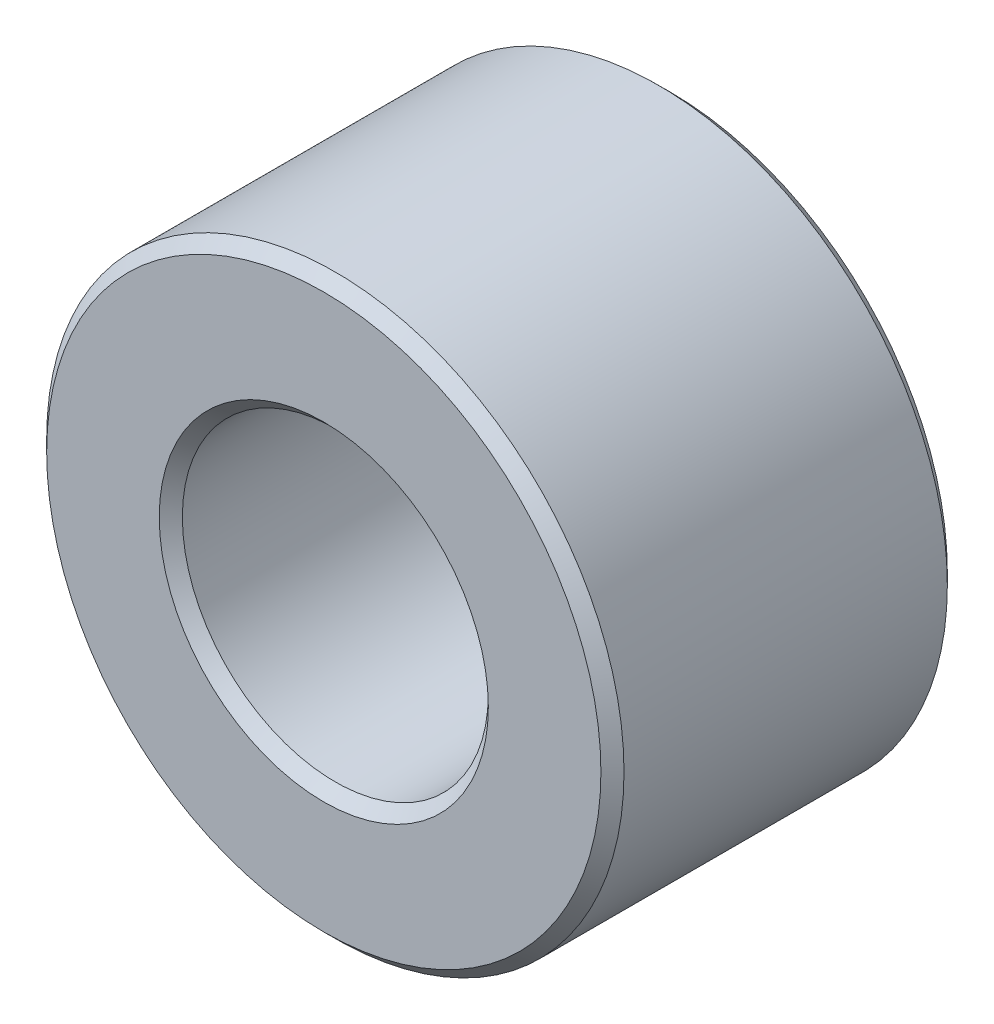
SolidWorks part; units mm, degrees
ref_plane "Front Plane" through (0, 0, 0) normal (0, 0, 1) x (1, 0, 0)
ref_plane "Top Plane" through (0, 0, 0) normal (0, 1, 0) x (1, 0, 0)
ref_plane "Right Plane" through (0, 0, 0) normal (1, 0, 0) x (0, 0, -1)
sketch "Sketch1" plane through (0, 0, 0) normal (0, 0, 1) x (1, 0, 0)
  circle A0 centre (0, 0) radius 5
  circle A1 centre (0, 0) radius 2.65
  dimension "D1" = 10
  dimension "D2" = 5.3
extrude "Boss-Extrude2" add sketch "Sketch1" along normal mid plane 6
chamfer "Chamfer3" distance 0.2 angle 45 4 edges at (5, 0, 3) (5, 0, -3) (2.65, 0, -3) (2.65, 0, 3)
